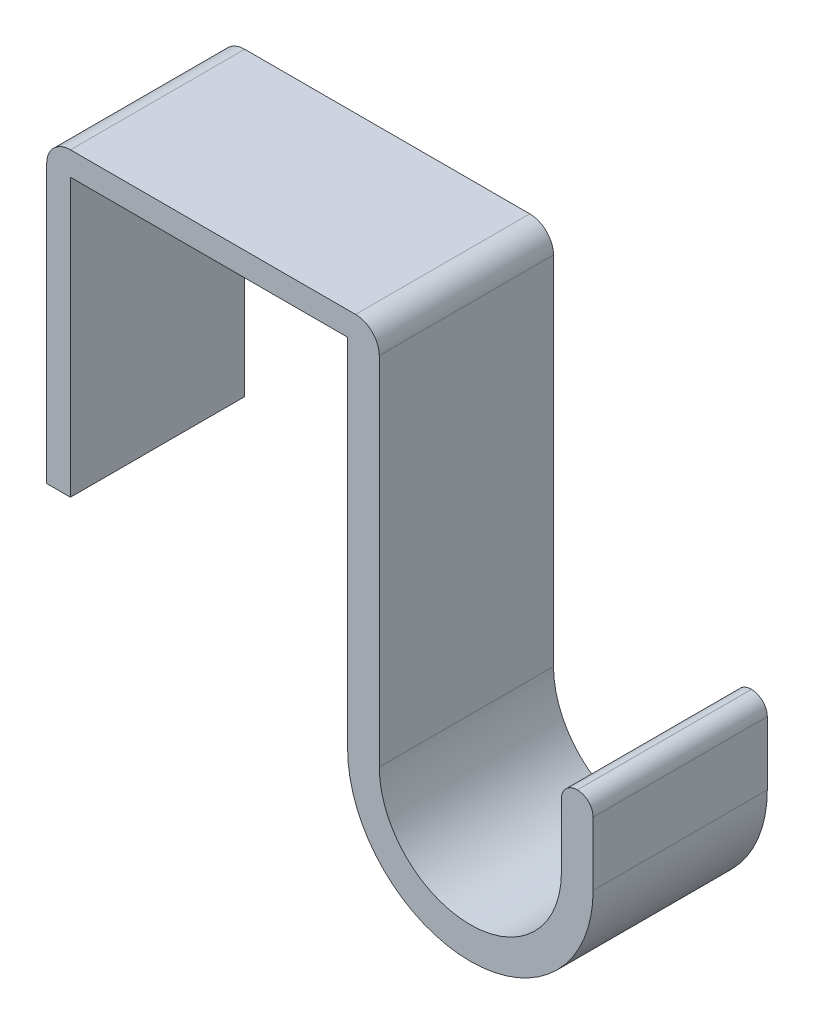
SolidWorks part; units mm, degrees
ref_plane "Front" through (0, 0, 0) normal (0, 0, 1) x (1, 0, 0)
ref_plane "Top" through (0, 0, 0) normal (0, 1, 0) x (1, 0, 0)
ref_plane "Right" through (0, 0, 0) normal (1, 0, 0) x (0, 0, -1)
sketch "Sketch1" plane through (0, 0, 0) normal (0, 0, 1) x (1, 0, 0)
  line L0 (0, 0) -> (-35, 0)
  line L1 (-35, 0) -> (-35, -35)
  line L2 (-35, -35) -> (-38, -35)
  line L3 (-38, -35) -> (-38, 0)
  line L4 (-35, 3) -> (1, 3)
  line L5 (4, 0) -> (4, -45)
  line L6 (0, 0) -> (0, -45)
  line L7 (27, -45) -> (27, -36.99)
  line L8 (28.99, -35) -> (29.01, -35)
  line L9 (31, -36.99) -> (31, -45)
  arc A0 (4, -45) -> (27, -45) centre (15.5, -45) ccw
  arc A1 (0, -45) -> (31, -45) centre (15.5, -45) ccw
  arc A2 (-38, 0) -> (-35, 3) centre (-35, 0) cw
  arc A3 (1, 3) -> (4, 0) centre (1, 0) cw
  arc A4 (27, -36.99) -> (28.99, -35) centre (28.99, -36.99) cw
  arc A5 (29.01, -35) -> (31, -36.99) centre (29.01, -36.99) cw
  point P21 (27, -35)
  point P24 (31, -35)
  dimension "D3" = 23
  dimension "D9" = 3
  dimension "D10" = 1.99
  dimension "D1" = 4
  dimension "D2" = 4
  dimension "D4" = 10
  dimension "D5" = 35
  dimension "D6" = 3
  dimension "D7" = 3
  dimension "D8" = 35
extrude "Boss-Extrude1" add sketch "Sketch1" along normal blind 22
